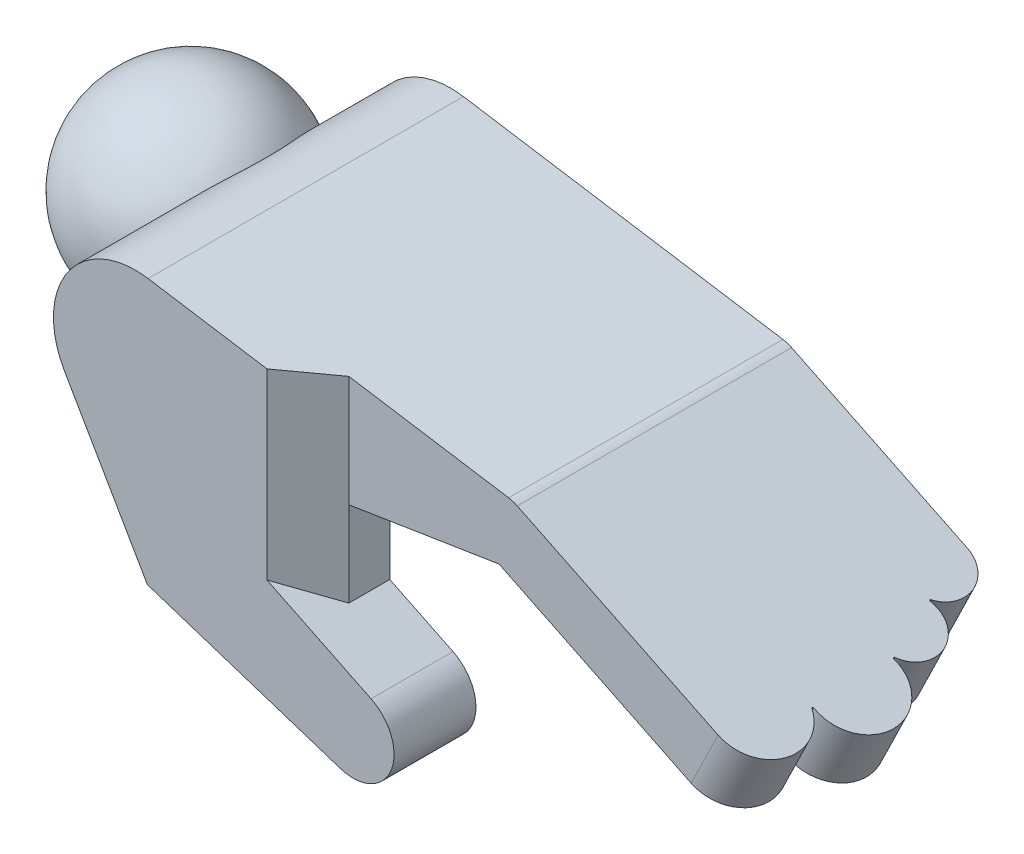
SolidWorks part; units mm, degrees
ref_plane "Front Plane" through (0, 0, 0) normal (0, 0, 1) x (1, 0, 0)
ref_plane "Top Plane" through (0, 0, 0) normal (0, 1, 0) x (1, 0, 0)
ref_plane "Right Plane" through (0, 0, 0) normal (1, 0, 0) x (0, 0, -1)
mirrored part "RIGHT HAND_Mirrored"
other "<RIGHT HAND>-<Revolve1>"
